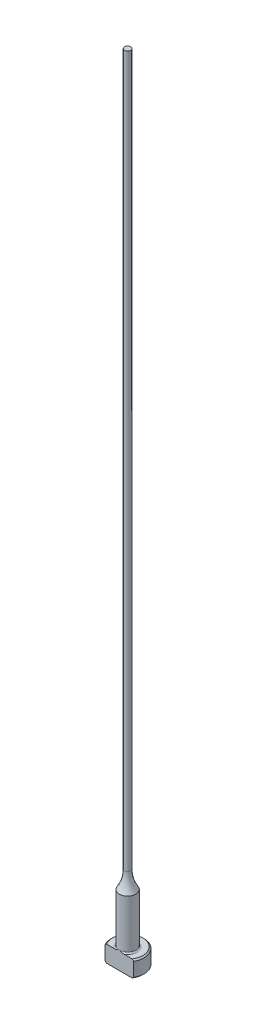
SolidWorks part; units mm, degrees
ref_plane "Front Plane" through (0, 0, 0) normal (0, 0, 1) x (1, 0, 0)
ref_plane "Top Plane" through (0, 0, 0) normal (0, 1, 0) x (1, 0, 0)
ref_plane "Right Plane" through (0, 0, 0) normal (1, 0, 0) x (0, 0, -1)
sketch "Sketch1" plane through (0, 0, 0) normal (0, 0, 1) x (1, 0, 0)
  line L0 (0, 259.9588) -> (0, -15.1925) construction
  line L1 (0, 0) -> (-3.175, 0)
  line L2 (-3.175, 0) -> (-3.175, 3.175)
  line L3 (-3.175, 3.175) -> (-1.5875, 3.175)
  line L4 (-0.5944, 16.1098) -> (-0.5944, 152.4)
  line L5 (-0.5944, 152.4) -> (0, 152.4)
  line L6 (0, 152.4) -> (0, 0)
  line L7 (-1.5875, 3.175) -> (-1.5875, 12.7)
  arc A0 (-1.5875, 12.7) -> (-0.5944, 16.1098) centre (-6.9444, 16.1098) ccw
  point P13 (-1.5875, 0)
  dimension "D1" = 6.35
  dimension "L" = 152.4
  dimension "D2" = 3.175
  dimension "H" = 6.35
  dimension "T" = 3.175
  dimension "D" = 1.1887
  dimension "S" = 12.7
revolve "Revolve1" add sketch "Sketch1" angle 360 about L0
chamfer "Chamfer1" distance 0.254 angle 45 2 edges at (0, 3.175, 3.175) (0, 0, 3.175)
fillet "Fillet1" radius 0.254 1 edges at (0, 3.175, 1.5875)
sketch "Sketch2" plane through (0, 0, 0) normal (0, -1, 0) x (1, 0, 0)
  line L0 (-2.7496, 1.5875) -> (2.7496, 1.5875)
  arc A0 (2.7496, 1.5875) -> (-2.7496, 1.5875) centre (0, 0) ccw
  circle A1 centre (0, 0) radius 3.175 construction
  circle A2 centre (0, 0) radius 1.5875 construction
extrude "Cut-Extrude1" cut sketch "Sketch2" against normal through all
